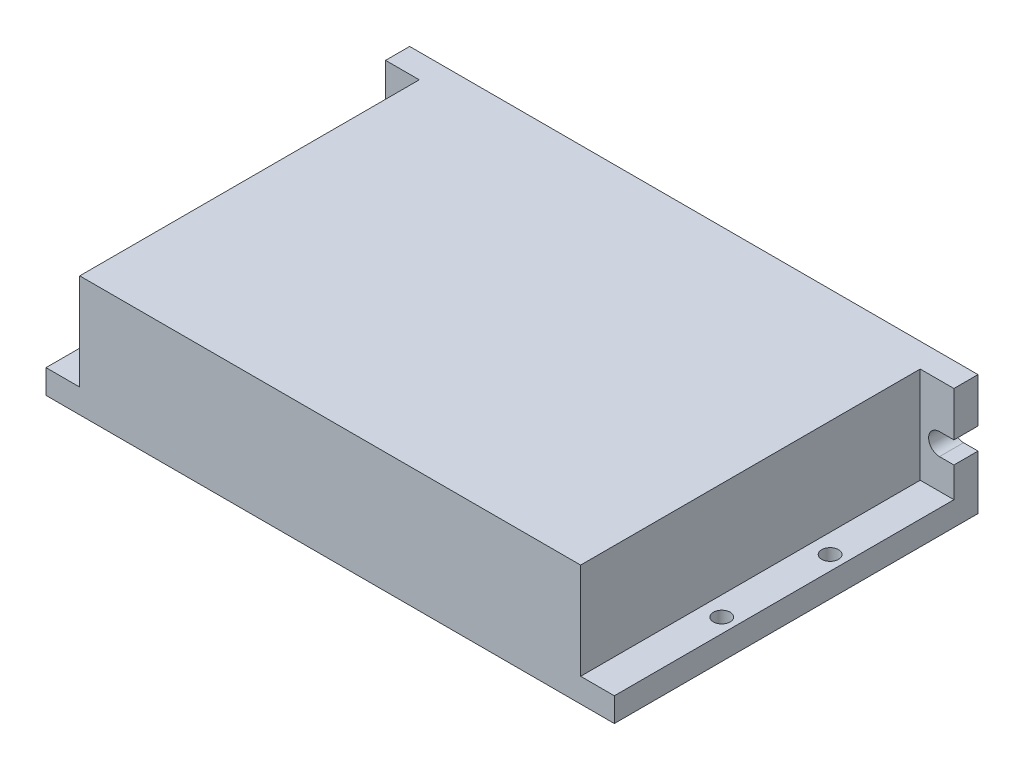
SolidWorks part; units mm, degrees
ref_plane "前视" through (0, 0, 0) normal (0, 0, 1) x (1, 0, 0)
ref_plane "上视" through (0, 0, 0) normal (0, 1, 0) x (1, 0, 0)
ref_plane "右视" through (0, 0, 0) normal (1, 0, 0) x (0, 0, -1)
sketch "草图1" plane through (0, 0, 0) normal (0, 1, 0) x (1, 0, 0)
  line L1 (-59, -37.75) -> (59, -37.75)
  line L2 (-59, -37.75) -> (-59, 37.75)
  line L3 (-59, 37.75) -> (59, 37.75)
  line L4 (59, -37.75) -> (59, 37.75)
  line L5 (-59, -37.75) -> (59, 37.75) construction
  line L6 (-59, 37.75) -> (59, -37.75) construction
  point P0 (0, 0)
extrude "凸台-拉伸1" add sketch "草图1" along normal blind 25
ref_plane "基准面1" through (0, 0, 37.75) normal (0, 0, 1) x (1, 0, 0)
sketch "草图3" plane through (0, 0, 37.75) normal (0, 0, 1) x (1, 0, 0)
  line L0 (-59, 25) -> (-52, 25)
  line L1 (-59, 25) -> (59, 25) construction
  line L2 (-52, 25) -> (-52, 5)
  line L3 (-52, 5) -> (-59, 5)
  line L4 (-59, 25) -> (-59, 0) construction
  line L5 (-59, 5) -> (-59, 25)
  line L6 (59, 25) -> (52, 25)
  line L7 (52, 25) -> (52, 5)
  line L8 (52, 5) -> (59, 5)
  line L9 (59, 25) -> (59, 0) construction
  line L10 (59, 5) -> (59, 25)
extrude "切除-拉伸1" cut sketch "草图3" against normal blind 70.5
sketch "草图4" plane through (0, 0, 0) normal (0, 1, 0) x (1, 0, 0)
  circle A0 centre (-56, 10.05) radius 1.75
  circle A1 centre (-56, -12.45) radius 1.75
  circle A2 centre (56, 10.05) radius 1.75
  circle A3 centre (56, -12.45) radius 1.75
  dimension "D1" = 3.5
  dimension "D2" = 3.5
  dimension "D3" = 3.5
  dimension "D4" = 3.5
extrude "切除-拉伸3" cut sketch "草图4" along normal blind 5
ref_plane "基准面2" through (0, 0, -32.75) normal (0, 0, 1) x (1, 0, 0)
sketch "草图5" plane through (0, 0, -32.75) normal (0, 0, 1) x (1, 0, 0)
  line L2 (59, 5) -> (59, 25) construction
  line L4 (56, 15.75) -> (59, 15.75)
  line L6 (56, 11.25) -> (59, 11.25)
  line L7 (59, 15.75) -> (59, 11.25)
  line L8 (-56, 15.75) -> (-59, 15.75)
  line L10 (-56, 11.25) -> (-59, 11.25)
  line L11 (-59, 15.75) -> (-59, 11.25)
  arc A0 (-56, 15.75) -> (-56, 11.25) centre (-56, 13.5) cw
  arc A1 (56, 15.75) -> (56, 11.25) centre (56, 13.5) ccw
  dimension "D1" = 2.25
  dimension "D2" = 2.25
extrude "切除-拉伸4" cut sketch "草图5" against normal blind 5
